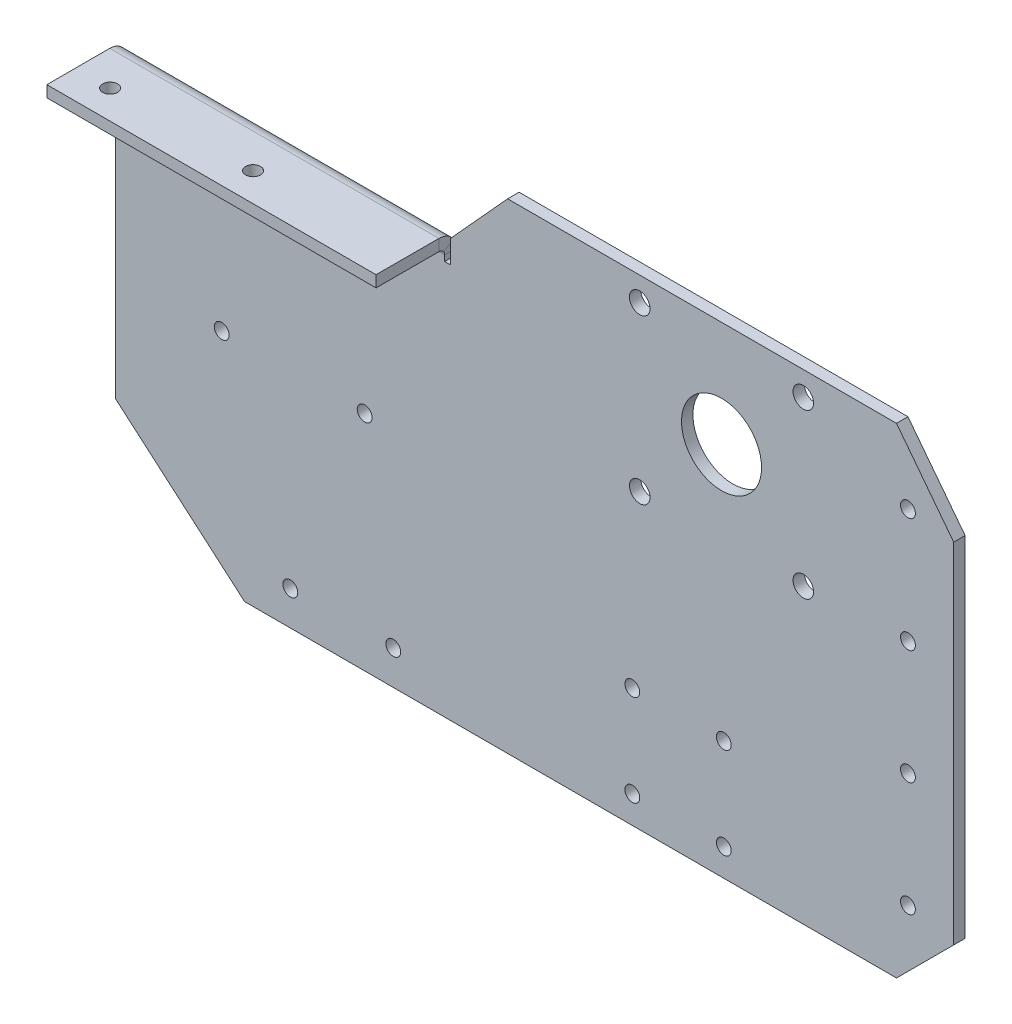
SolidWorks part; units mm, degrees
ref_plane "Front" through (0, 0, 0) normal (0, 0, 1) x (1, 0, 0)
ref_plane "Top" through (0, 0, 0) normal (0, 1, 0) x (1, 0, 0)
ref_plane "Right" through (0, 0, 0) normal (1, 0, 0) x (0, 0, -1)
sketch "Esquisse1" plane through (0, 0, 0) normal (0, 0, 1) x (1, 0, 0)
  line L0 (749.999, -0.001) -> (179.999, -0.001)
  line L2 (67.1428, 364.999) -> (354.999, 364.999)
  line L3 (354.999, 364.999) -> (354.999, 346.999)
  line L4 (354.999, 346.999) -> (359.999, 346.999)
  line L5 (359.999, 346.999) -> (359.999, 364.999)
  line L6 (359.999, 364.999) -> (409.999, 419.999)
  line L7 (409.999, 419.999) -> (749.999, 419.999)
  line L8 (799.999, 354.999) -> (799.999, 49.999)
  line L9 (179.999, -0.001) -> (67.1428, 97.1807)
  line L10 (799.999, 49.999) -> (749.999, -0.001)
  line L11 (749.999, 419.999) -> (799.999, 354.999)
  line L12 (759.999, 365.8282) -> (759.999, 343.1853) construction
  line L13 (764.9957, 359.999) -> (744.5185, 359.999) construction
  line L14 (67.1428, 364.999) -> (67.1428, 97.1807)
  circle A0 centre (759.999, 359.999) radius 6.5
  circle A1 centre (668.499, 398.999) radius 9
  circle A2 centre (668.499, 255.999) radius 9
  circle A3 centre (525.499, 398.999) radius 9
  circle A4 centre (525.499, 255.999) radius 9
  circle A5 centre (759.999, 259.999) radius 6.5
  circle A6 centre (596.999, 327.499) radius 35
  circle A7 centre (598.999, 103.999) radius 6.5
  circle A8 centre (598.999, 23.999) radius 6.5
  circle A9 centre (518.999, 103.999) radius 6.5
  circle A10 centre (518.999, 23.999) radius 6.5
  circle A11 centre (309.999, 29.999) radius 6.5
  circle A12 centre (219.999, 29.999) radius 6.5
  circle A14 centre (159.999, 194.999) radius 6.5
  circle A15 centre (284.999, 194.999) radius 6.5
  circle A17 centre (159.999, 314.999) radius 6.5
  circle A18 centre (284.999, 314.999) radius 6.5
  circle A19 centre (759.999, 159.999) radius 6.5
  circle A20 centre (759.999, 59.999) radius 6.5
  point P1 (-0.001, -0.001)
  point P9 (799.999, 419.999)
  point P10 (799.999, -0.001)
  dimension "D14" = 13
  dimension "D17" = 18
  dimension "D18" = 18
  dimension "D19" = 18
  dimension "D20" = 18
  dimension "D31" = 13
  dimension "D34" = 70
  dimension "D37" = 13
  dimension "D38" = 13
  dimension "D39" = 13
  dimension "D40" = 13
  dimension "D49" = 13
  dimension "D50" = 13
  dimension "D60" = 13
  dimension "D61" = 13
  dimension "D65" = 13
  dimension "D66" = 13
  dimension "D74" = 100
  dimension "D32" = 13
  dimension "D33" = 13
  dimension "D1" = 800
  dimension "D3" = 18
  dimension "D4" = 18
  dimension "D5" = 5
  dimension "D6" = 50
  dimension "D7" = 440
  dimension "D8" = 420
  dimension "D9" = 180
  dimension "D13" = 50
  dimension "D11" = 65
  dimension "D12" = 50
  dimension "D15" = 60
  dimension "D16" = 40
  dimension "D21" = 143
  dimension "D22" = 131.5
  dimension "D23" = 143
  dimension "D24" = 131.5
  dimension "D25" = 21
  dimension "D26" = 21
  dimension "D27" = 143
  dimension "D28" = 143
  dimension "D29" = 0.001
  dimension "D35" = 203
  dimension "D36" = 92.5
  dimension "D41" = 80
  dimension "D42" = 80
  dimension "D43" = 24
  dimension "D44" = 201
  dimension "D45" = 24
  dimension "D46" = 80
  dimension "D47" = 80
  dimension "D48" = 201
  dimension "D51" = 90
  dimension "D52" = 30
  dimension "D53" = 30
  dimension "D54" = 209
  dimension "D57" = 125
  dimension "D69" = 120
  dimension "D71" = 120
  dimension "D75" = 100
  dimension "D76" = 100
  dimension "D77" = 40
  dimension "D78" = 40
  dimension "D79" = 40
extrude "Base-Extrusion" add sketch "Esquisse1" along normal blind 10
sketch "Esquisse2" plane through (0, 364.999, 0) normal (0, 1, 0) x (-1, 0, 0)
  line L0 (-354.999, 0) -> (-67.1428, 0) construction
  line L1 (-354.999, 0) -> (-67.1428, 0)
  line L2 (-354.999, 0) -> (-354.9349, 70)
  line L3 (-354.9349, 70) -> (-67.1428, 70)
  line L5 (-67.1428, 0) -> (-67.1428, 70)
  line L6 (-354.999, 10) -> (-67.1428, 10) construction
  circle A0 centre (-222.4349, 45) radius 6.5
  circle A1 centre (-97.4349, 45) radius 6.5
  dimension "D5" = 13
  dimension "D6" = 13
  dimension "D3" = 35
  dimension "D4" = 35
  dimension "D7" = 125
extrude "Boss.-Extru.1" add sketch "Esquisse2" against normal blind 10
sheet metal parameters "Tôlerie 1" parameters "D1"=5, "Epaisseur"=10
bend "Pli dans angle1" bend angle 90 parameters "D1"=0, "D5"=1
flatten bends "Dépliage 1" parameters "D1"=0
sketch "Esquisse-Angle1" plane through (0, 0, 10) normal (0, 0, 1) x (1, 0, 0)
  line L0 (354.9898, 353.9417) -> (67.1428, 353.9417) construction
process bends "Pliage 1" parameters "D1"=0
sketch "Esquisse-Plate1" plane through (0, 0, 10) normal (0, 0, 1) x (1, 0, 0)
